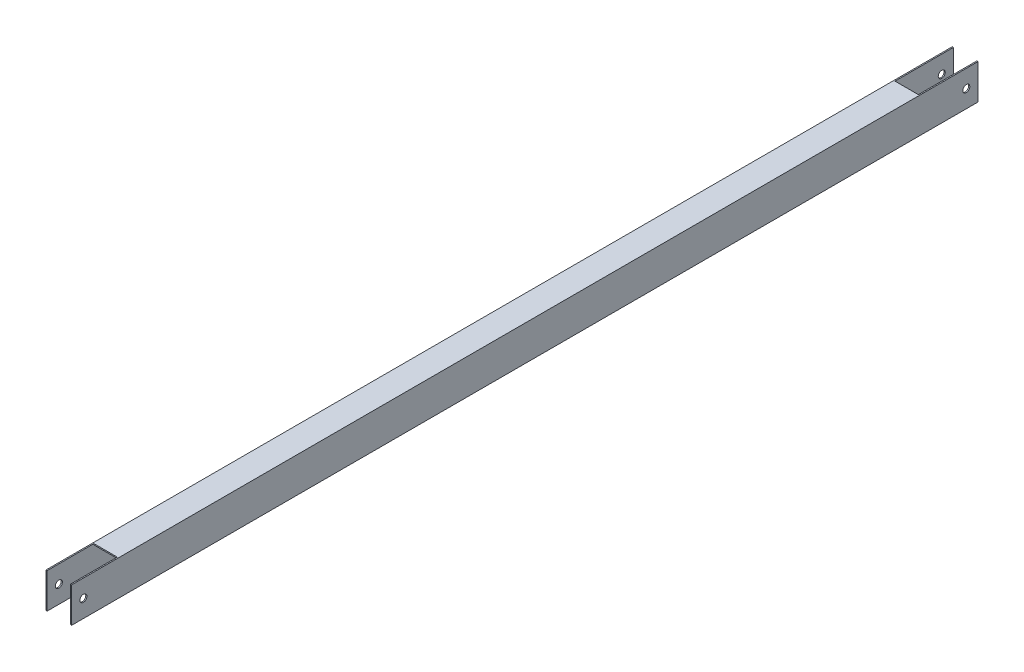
SolidWorks part; units mm, degrees
ref_plane "Plan de face" through (0, 0, 0) normal (0, 0, 1) x (1, 0, 0)
ref_plane "Plan de dessus" through (0, 0, 0) normal (0, 1, 0) x (1, 0, 0)
ref_plane "Plan de droite" through (0, 0, 0) normal (1, 0, 0) x (0, 0, -1)
sketch "Esquisse1" plane through (0, 0, 0) normal (0, 0, 1) x (1, 0, 0)
  line L1 (-22, 30) -> (22, 30)
  line L2 (-22, 30) -> (-22, -30)
  line L3 (-22, -30) -> (22, -30)
  line L4 (22, 30) -> (22, -30)
  line L5 (-22, 30) -> (22, -30) construction
  line L6 (-22, -30) -> (22, 30) construction
  line L7 (-20, 28) -> (20, 28)
  line L8 (-20, 28) -> (-20, -28)
  line L9 (-20, -28) -> (20, -28)
  line L10 (20, 28) -> (20, -28)
  line L11 (-20, 28) -> (20, -28) construction
  line L12 (-20, -28) -> (20, 28) construction
  point P0 (0, 0)
  point P6 (0, 0)
  dimension "D1" = 44
  dimension "D2" = 60
  dimension "D3" = 56
  dimension "D4" = 40
sketch "Esquisse2" plane through (0, 0, 0) normal (0, 1, 0) x (1, 0, 0)
  line L0 (0, 0) -> (0, 1450)
  dimension "D1" = 1450
sweep "Balayage1" add profiles "Esquisse1" path "Esquisse2"
sketch "Esquisse4" plane through (0, 0, 0) normal (0, 0, 1) x (1, 0, 0)
  line L0 (20, 28) -> (20, -28) construction
  line L1 (-20, -30) -> (20, -30)
  line L2 (-20, -30) -> (-20, 30)
  line L3 (-20, 30) -> (20, 30)
  line L4 (20, -30) -> (20, 30)
  line L5 (-20, -30) -> (20, 30) construction
  line L6 (-20, 30) -> (20, -30) construction
  line L7 (-22, 30) -> (22, 30) construction
  point P0 (0, 0)
  dimension "D1" = 0
  dimension "D2" = 0
extrude "Enlèv. mat.-Extru.1" cut sketch "Esquisse4" against normal blind 80
hole_wizard "Dégagement M101" positions "Esquisse3D1" profile "Esquisse5" hole size "M10" standard "ISO"
sketch3d "Esquisse3D1"
  line L0 (22, 30, 0) -> (22, 30, -1450) construction
  line L1 (22, -30, 0) -> (22, 30, 0) construction
  point P0 (22, 0, -20)
  dimension "D1" = 30
  dimension "D2" = 20
sketch "Esquisse5" plane through (22, 0, -20) normal (0, 1, 0) x (0, 0, -1)
  line L0 (0, 0) -> (0, 44)
  line L1 (0, 44) -> (6, 44)
  line L2 (6, 44) -> (6, 0)
  line L5 (6, 0) -> (0, 0)
  line L11 (0, -6.35) -> (0, 107.95) construction
  dimension "Diamètre du perçage jusqu'au prochain" = 12
  dimension "Profondeur du perçage jusqu'au prochain" = 44
sketch "Esquisse6" plane through (0, 0, -1450) normal (0, 0, -1) x (-1, 0, 0)
  line L1 (-22, 30) -> (-20, 30)
  line L2 (-22, 30) -> (-22, -30)
  line L3 (-22, -30) -> (-20, -30)
  line L4 (-20, 30) -> (-20, -30)
  line L5 (22, 30) -> (20, 30)
  line L6 (22, 30) -> (22, -30)
  line L7 (22, -30) -> (20, -30)
  line L8 (20, 30) -> (20, -30)
extrude "Boss.-Extru.1" add sketch "Esquisse6" along normal blind 100
hole_wizard "Dégagement M102" positions "Esquisse3D2" profile "Esquisse7" hole size "M10" standard "ISO"
sketch3d "Esquisse3D2"
  line L0 (-22, 30, 0) -> (-22, 30, -1550) construction
  line L1 (-22, -30, -1550) -> (-22, 30, -1550) construction
  point P0 (-22, 0, -1530)
  dimension "D1" = 30
  dimension "D2" = 20
sketch "Esquisse7" plane through (-22, 0, -1530) normal (0, 1, 0) x (0, 0, 1)
  line L0 (0, 0) -> (0, 44)
  line L1 (0, 44) -> (6, 44)
  line L2 (6, 44) -> (6, 0)
  line L5 (6, 0) -> (0, 0)
  line L11 (0, -6.35) -> (0, 107.95) construction
  dimension "Diamètre du perçage jusqu'au prochain" = 12
  dimension "Profondeur du perçage jusqu'au prochain" = 44
